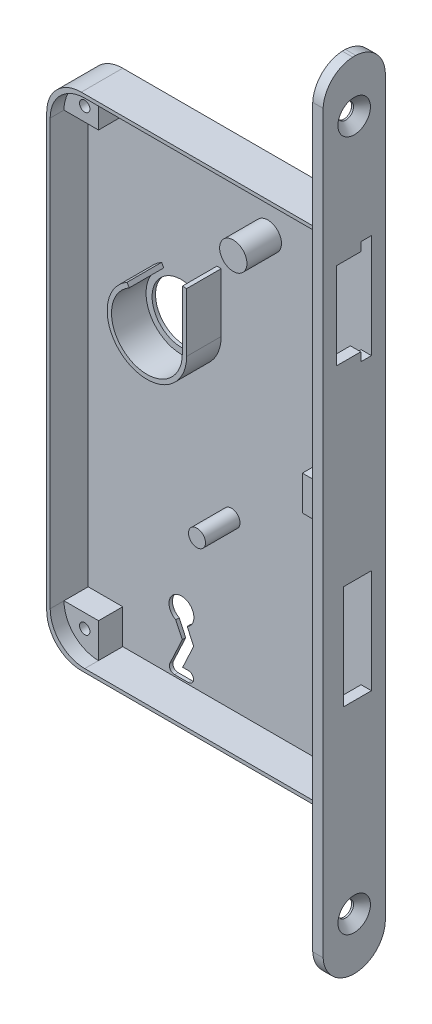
SolidWorks part; units mm, degrees
ref_plane "Ebene vorne" through (0, 0, 0) normal (0, 0, 1) x (1, 0, 0)
ref_plane "Ebene oben" through (0, 0, 0) normal (0, 1, 0) x (1, 0, 0)
ref_plane "Ebene rechts" through (0, 0, 0) normal (1, 0, 0) x (0, 0, -1)
sketch "Skizze1" plane through (0, 0, 0) normal (0, 0, 1) x (1, 0, 0)
  line L0 (0, 115) -> (0, -115)
  line L1 (0, -115) -> (-3, -115)
  line L2 (-3, -115) -> (-3, -72.5)
  line L3 (-3, -72.5) -> (-73, -72.5)
  line L4 (-83, 62.5) -> (-83, -62.5)
  line L5 (-73, 72.5) -> (-3, 72.5)
  line L6 (-3, 72.5) -> (-3, 115)
  line L7 (-3, 115) -> (0, 115)
  line L8 (-83.043, 0) -> (-13.043, 0) construction
  arc A0 (-83, 62.5) -> (-73, 72.5) centre (-73, 62.5) cw
  arc A1 (-83, -62.5) -> (-73, -72.5) centre (-73, -62.5) ccw
  dimension "D6" = 10
  dimension "D1" = 230
  dimension "D2" = 80
  dimension "D3" = 42.5
  dimension "D4" = 145
  dimension "D5" = 3
extrude "Linear austragen1" add sketch "Skizze1" along normal mid plane 18
sketch "Skizze2" plane through (0, 0, 0) normal (0, 0, 1) x (1, 0, 0)
  line L0 (-72, 71.5) -> (-3, 71.5)
  line L1 (-3, 71.5) -> (-3, 5)
  line L2 (-3, -71.5) -> (-72, -71.5)
  line L3 (-82, 61.5) -> (-82, -61.5)
  line L5 (-3, 72.5) -> (-73, 72.5) construction
  line L6 (-82, 61.5) -> (-72, 61.5)
  line L7 (-72, 61.5) -> (-72, 71.5)
  line L8 (-82, -61.5) -> (-72, -61.5)
  line L9 (-72, -61.5) -> (-72, -71.5)
  line L10 (-3, 5) -> (-13, 5)
  line L11 (-13, 5) -> (-13, -5)
  line L12 (-13, -5) -> (-3, -5)
  line L13 (-3, -5) -> (-3, -71.5)
  line L14 (2.3281, 0) -> (-85.308, 0) construction
  line L15 (0, -115) -> (0, 115) construction
  dimension "D5" = 10
  dimension "D6" = 10
  dimension "D1" = 10
  dimension "D2" = 10
  dimension "D3" = 143
  dimension "D4" = 1
  dimension "D7" = 10
  dimension "D8" = 10
  dimension "D9" = 3
  dimension "D10" = 3
  dimension "D11" = 79
extrude "Kastenhohlraum" cut sketch "Skizze2" against normal blind 5 and the other way through all
ref_plane "Ebene1" through (-83, 0, 0) normal (1, 0, 0) x (0, 0, -1)
sketch "Skizze3" plane through (-83, 0, 0) normal (1, 0, 0) x (0, 0, -1)
  line L0 (-9, -72.5) -> (9, -72.5) construction
  line L1 (-9, 72.5) -> (-6, 72.5)
  line L2 (-9, 72.5) -> (-9, -72.5)
  line L3 (-9, -72.5) -> (-6, -72.5)
  line L4 (-6, 72.5) -> (-6, -72.5)
  line L6 (9, 72.5) -> (6, 72.5)
  line L7 (9, 72.5) -> (9, -72.5)
  line L8 (9, -72.5) -> (6, -72.5)
  line L9 (6, 72.5) -> (6, -72.5)
  dimension "D1" = 3
  dimension "D2" = 3
extrude "Kastenbreite" cut sketch "Skizze3" along normal blind 80
sketch "Skizze4" plane through (0, 0, 0) normal (1, 0, 0) x (0, 0, -1)
  line L0 (-9, -115) -> (-9, 115) construction
  line L1 (9, -115) -> (9, 115) construction
  line L2 (-9, 106.4442) -> (-9, 115)
  line L3 (-9, 115) -> (9, 115)
  line L4 (9, 115) -> (9, 106.4442)
  line L5 (-9, -105.5036) -> (-9, -115)
  line L6 (-9, -115) -> (9, -115)
  line L7 (9, -115) -> (9, -105.5036)
  arc A0 (-9, 106.4442) -> (9, 106.4442) centre (0, 106) cw
  arc A1 (-9, -105.5036) -> (9, -105.5036) centre (0, -106) ccw
  dimension "D1" = 106
  dimension "D2" = 106
extrude "Stulpabrundung" cut sketch "Skizze4" against normal up to next contours L3 A0 L4 | L2 A0 L3 | A1 L6 L7 | A1 L5 L6
sketch "Skizze5" plane through (0, 0, 0) normal (1, 0, 0) x (0, 0, -1)
  line L0 (0, 119.5006) -> (0, -118.8724) construction
  line L1 (-7.0664, 52.5) -> (6.1242, 52.5) construction
  line L2 (5, 67.55) -> (5, 37.45)
  line L3 (5, 37.45) -> (1.9, 37.45)
  line L4 (1.9, 37.45) -> (1.9, 39.95)
  line L5 (1.9, 39.95) -> (-5.1, 39.95)
  line L6 (-5.1, 39.95) -> (-5.1, 65.05)
  line L7 (-5.1, 65.05) -> (1.9, 65.05)
  line L8 (1.9, 65.05) -> (1.9, 67.55)
  line L9 (1.9, 67.55) -> (5, 67.55)
  line L10 (-7.0664, -31.5) -> (6.1242, -31.5) construction
  line L11 (-3.1, -16.45) -> (-3.1, -46.55)
  line L12 (-3.1, -46.55) -> (5, -46.55)
  line L13 (5, -46.55) -> (5, -16.45)
  line L14 (5, -16.45) -> (-3.1, -16.45)
  dimension "D1" = 52.5
  dimension "D2" = 30.1
  dimension "D3" = 25.1
  dimension "D4" = 10.1
  dimension "D5" = 3.1
  dimension "D6" = 5
  dimension "D7" = 31.5
  dimension "D8" = 8.1
  dimension "D9" = 30.1
  dimension "D10" = 5
extrude "Aussparung für Falle und Riegell" cut sketch "Skizze5" against normal blind 10
hole_wizard "Formsenkung für M4 Senkschraube mit Schlitz/Kreuzschlitz1" positions "3D-Skizze2" profile "Skizze11" countersink size "M4" standard "DIN"
sketch3d "3D-Skizze2"
  point P0 (0, 100, 0)
  point P2 (0, -100, 0)
  dimension "D1" = 100
  dimension "D2" = 100
sketch "Skizze11" plane through (0, 100, 0) normal (0, 1, 0) x (0, 0, -1)
  line L0 (0, 0) -> (0, 3)
  line L1 (0, 3) -> (2.275, 3)
  line L2 (2.25, 2.975) -> (2.25, 2.45)
  line L3 (2.25, 2.45) -> (4.7, 0)
  line L5 (4.7, 0) -> (0, 0)
  line L6 (-2.25, 2.45) -> (-4.7, 0) construction
  line L7 (2.275, 3) -> (2.25, 2.975)
  line L8 (-2.275, 3) -> (-2.25, 2.975) construction
  line L11 (0, -6.35) -> (0, 107.95) construction
  dimension "Bohrerdurchmesser" = 4.5
  dimension "Bohrungstiefe" = 3
  dimension "Senkdurchmesser (Oben)" = 9.4
  dimension "Senkwinkel (Oben)" = 90
  dimension "Senkdurchmesser (Unten)" = 4.55
  dimension "Senkwinkel (Unten)" = 90
sketch "Skizze12" plane through (0, 0, -5) normal (0, 0, 1) x (1, 0, 0)
  line L0 (6.2213, 52.5) -> (-80.0098, 52.5) construction
  line L1 (-3, 106.4442) -> (-3, -106.4964) construction
  line L2 (6.2213, -23.5) -> (-80.0098, -23.5) construction
  line L3 (-43.5, 20.5) -> (-43.5, 37.5)
  line L4 (-65, 20.5) -> (-45, 20.5) construction
  line L5 (-55, 30.5) -> (-55, 10.5) construction
  line L6 (-3, -72.5) -> (-73, -72.5) construction
  line L7 (-43.5, 37.5) -> (-44.75, 37.5)
  line L8 (-60.125, 29.3768) -> (-60.75, 30.4593)
  line L9 (-55, 20.5) -> (-38.5006, 20.5) construction
  line L10 (-55, 20.5) -> (-63.2571, 34.8017) construction
  line L11 (-3, -71.5) -> (-3, -46.55) construction
  line L12 (-3, 5) -> (-3, 37.45) construction
  line L13 (-44.75, 37.5) -> (-44.75, 20.5)
  circle A0 centre (-30, 52.5) radius 3.95
  circle A1 centre (-40.5, -23.5) radius 2.45
  circle A2 centre (-55, 20.5) radius 10 construction
  arc A3 (-43.5, 20.5) -> (-60.75, 30.4593) centre (-55, 20.5) cw
  arc A4 (-44.75, 20.5) -> (-60.125, 29.3768) centre (-55, 20.5) cw
  dimension "D2" = 7.9
  dimension "D5" = 4.9
  dimension "D9" = 20
  dimension "D11" = 11.5
  dimension "D12" = 10.25
  dimension "D1" = 52.5
  dimension "D3" = 27
  dimension "D4" = 23.5
  dimension "D6" = 37.5
  dimension "D7" = 52
  dimension "D8" = 93
  dimension "D10" = 30
  dimension "D13" = 120
  dimension "D14" = 17
extrude "Linear austragen7" add sketch "Skizze12" along normal blind 10
sketch "Skizze13" plane through (0, 0, -5) normal (0, 0, 1) x (1, 0, 0)
  line L0 (-68.3038, 20.5) -> (-29.5678, 20.5) construction
  line L1 (-55, 32.6824) -> (-55, 5.6664) construction
  line L2 (-3, -72.5) -> (-73, -72.5) construction
  line L4 (-3, 5) -> (-3, 37.45) construction
  circle A0 centre (-55, 20.5) radius 8.5
  dimension "D3" = 17
  dimension "D1" = 93
  dimension "D2" = 52
extrude "Austrag für Nuss" cut sketch "Skizze13" against normal up to next
sketch "Skizze14" plane through (0, 0, -6) normal (0, 0, 1) x (1, 0, 0)
  line L0 (-56.6551, -57.097) -> (-54.7633, -61.154)
  line L1 (-54.7633, -61.154) -> (-58.3595, -68.8661)
  line L2 (-53.3449, -57.097) -> (-51.4531, -61.154)
  line L3 (-51.4531, -61.154) -> (-54.6455, -68)
  line L4 (-54.6455, -68) -> (-53, -68)
  line L5 (-57, -71) -> (-53, -71)
  line L6 (-55, -14.6826) -> (-55, -71.2267) construction
  line L7 (-58.1792, -57.5) -> (-51.4133, -57.5) construction
  line L8 (-83, -62.5) -> (-83, 62.5) construction
  line L9 (-3, -72.5) -> (-73, -72.5) construction
  arc A0 (-56.6551, -57.097) -> (-53.3449, -57.097) centre (-55, -53.9) cw
  arc A2 (-58.3595, -68.8661) -> (-57, -71) centre (-57, -69.5) ccw
  arc A3 (-53, -68) -> (-53, -71) centre (-53, -69.5) cw
  dimension "D1" = 3
  dimension "D2" = 3
  dimension "D3" = 3
  dimension "D4" = 4
  dimension "D5" = 130
  dimension "D6" = 13.5
  dimension "D7" = 28
  dimension "D8" = 3.6
  dimension "D9" = 15
  dimension "D10" = 1.5
extrude "Austrag für Schlüsselloch" cut sketch "Skizze14" along normal up to next
hole_wizard "M3 Gewindebohrung1" positions "3D-Skizze3" profile "Skizze15" tap size "M3" standard "ISO"
sketch3d "3D-Skizze3"
  line L0 (-13, -5, 6) -> (-13, 5, 6) construction
  line L1 (-3, -5, 6) -> (-13, -5, 6) construction
  line L7 (-3, 72.5, 6) -> (-73, 72.5, 6) construction
  line L8 (-83, -62.5, 6) -> (-83, 62.5, 6) construction
  line L9 (-3, -72.5, 6) -> (-73, -72.5, 6) construction
  point P0 (-76, 65.5, 6)
  point P2 (-76, -65.5, 6)
  point P4 (-8, 0, 6)
  dimension "D1" = 5
  dimension "D2" = 5
  dimension "D3" = 7
  dimension "D4" = 7
  dimension "D5" = 7
  dimension "D6" = 7
sketch "Skizze15" plane through (-76, 65.5, 6) normal (1, 0, 0) x (0, -1, 0)
  line L0 (0, 0) -> (0, 11.2511)
  line L1 (0, 11.2511) -> (1.25, 10.5)
  line L2 (1.25, 10.5) -> (1.25, 8)
  line L3 (1.25, 8) -> (1.5, 8)
  line L4 (1.5, 8) -> (1.5, 0)
  line L5 (1.5, 0) -> (0, 0)
  line L10 (0, 11.2511) -> (-1.25, 10.5) construction
  line L11 (0, -6.35) -> (0, 107.95) construction
  dimension "Bohrerdurchmesser" = 2.5
  dimension "Bohrungstiefe" = 10.5
  dimension "Nenndurchmesser" = 3
  dimension "Gewindelänge" = 8
  dimension "Spitzenwinkel" = 118
sketch "Skizze16" plane through (0, 0, 6) normal (0, 0, 1) x (1, 0, 0)
  line L0 (-82, 61.5) -> (-72, 61.5)
  line L1 (-13, 5) -> (-3, 5)
  line L2 (-13, 5) -> (-13, -5)
  line L3 (-13, -5) -> (-3, -5)
  line L4 (-3, 5) -> (-3, -5)
  line L5 (-13, 5) -> (-3, -5) construction
  line L6 (-13, -5) -> (-3, 5) construction
  line L7 (-72, 61.5) -> (-72, 71.5)
  line L8 (-82, -61.5) -> (-72, -61.5)
  line L9 (-72, -61.5) -> (-72, -71.5)
  arc A0 (-82, -61.5) -> (-72, -71.5) centre (-72, -61.5) ccw
  arc A1 (-72, 71.5) -> (-82, 61.5) centre (-72, 61.5) ccw
  point P0 (-8, 0)
extrude "Linear austragen9" cut sketch "Skizze16" against normal blind 4
